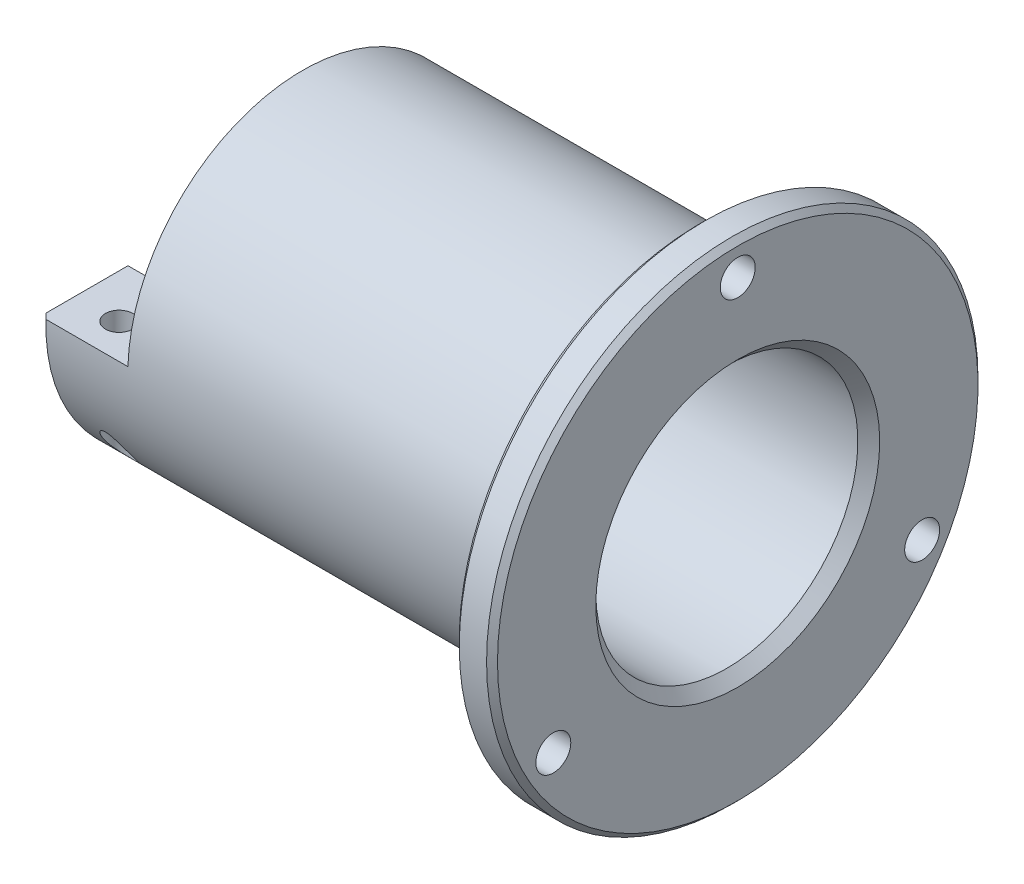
SolidWorks part; units mm, degrees
ref_plane "FACE" through (0, 0, 0) normal (0, 0, 1) x (1, 0, 0)
ref_plane "DESSUS" through (0, 0, 0) normal (0, 1, 0) x (1, 0, 0)
ref_plane "GAUCHE" through (0, 0, 0) normal (1, 0, 0) x (0, 0, -1)
sketch "Esquisse1" plane through (0, 0, 0) normal (0, 0, 1) x (1, 0, 0)
  line L0 (0, 0) -> (52, 0) construction
  line L1 (0, 8) -> (0, 16)
  line L2 (0, 16) -> (44.35, 16)
  line L3 (44.35, 16) -> (44.35, 22.5)
  line L4 (44.35, 22.5) -> (47.85, 22.5)
  line L5 (47.85, 22.5) -> (47.85, 12)
  line L6 (47.85, 12) -> (28.53, 12)
  line L7 (28.53, 12) -> (28.53, 10.5)
  line L8 (28.53, 10.5) -> (9.4, 10.5)
  line L9 (9.4, 10.5) -> (9.4, 8)
  line L10 (9.4, 8) -> (0, 8)
  dimension "D1" = 16
  dimension "D2" = 21
  dimension "D3" = 24
  dimension "D4" = 32
  dimension "D5" = 45
  dimension "D6" = 47.85
  dimension "D7" = 3.5
  dimension "D8" = 19.32
  dimension "D9" = 38.45
revolve "Base-Révolution" add sketch "Esquisse1" angle 360 about L0
sketch "Esquisse2" plane through (0, 0, 0) normal (-1, 0, 0) x (0, 0, 1)
  line L0 (-15.9922, 0.5) -> (-7.9844, 0.5)
  line L1 (7.9844, 0.5) -> (15.9922, 0.5)
  circle A0 centre (0, 0) radius 16 construction
  circle A1 centre (0, 0) radius 8 construction
  arc A2 (15.9922, 0.5) -> (-15.9922, 0.5) centre (0, 0) ccw
  arc A3 (7.9844, 0.5) -> (-7.9844, 0.5) centre (0, 0) ccw
  dimension "D1" = 0.5
extrude "Enlèv. mat.-Extru.1" cut sketch "Esquisse2" against normal blind 8
hole_wizard "Perçage3" positions "Esquisse9" profile "Esquisse8" tap size "M3x0.5" standard "ISO"
sketch "Esquisse9" plane through (0, 0.5, 0) normal (0, 1, 0) x (-1, 0, 0)
  line L0 (0, -15.9922) -> (0, -7.9844) construction
  line L1 (0, 0) -> (-52, 0) construction
  point P0 (-4, -12.8)
  dimension "D1" = 4
  dimension "D2" = 12.8
sketch "Esquisse8" plane through (4, 0.5, -12.8) normal (1, 0, 0) x (0, 0, 1)
  line L0 (0, 0) -> (0, 23)
  line L1 (0, 23) -> (1.25, 23)
  line L2 (1.25, 23) -> (1.25, 0)
  line L5 (1.25, 0) -> (0, 0)
  line L11 (0, -6.35) -> (0, 107.95) construction
  dimension "Diamètre du perçage jusqu'au prochain" = 2.5
  dimension "Profondeur du perçage jusqu'au prochain" = 23
mirror "Symétrie1" about plane through (0, 0, 0) normal (0, 0, 1)
sketch "Esquisse10" plane through (47.85, 0, 0) normal (1, 0, 0) x (0, 0, -1)
  circle A0 centre (0, 19.5) radius 1.6
  dimension "D1" = 3.2
  dimension "D2" = 19.5
extrude "Enlèv. mat.-Extru.2" cut sketch "Esquisse10" against normal through all
pattern_circular "Répétition circulaire1" count 3 every 120 about axis through (0, 0, 0) along (1, 0, 0)
chamfer "Chanfrein1" distance 1 angle 45
chamfer "Chanfrein2" distance 0.5 angle 45
fillet "Congé1" radius 0.5
